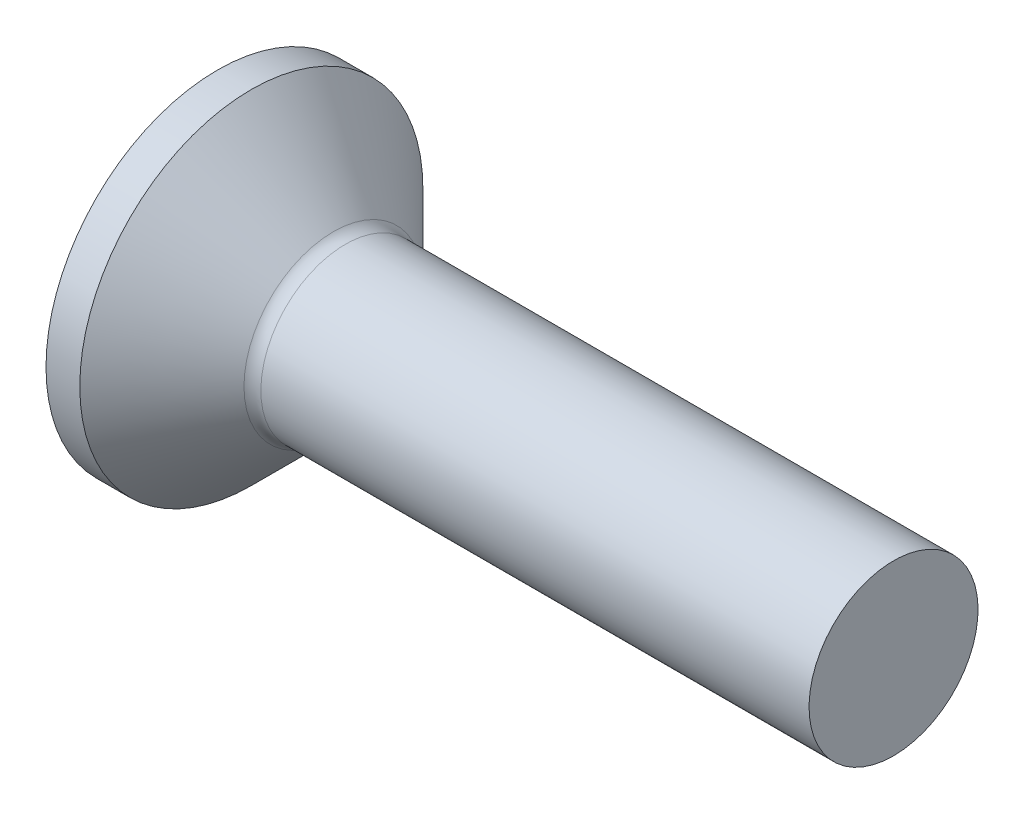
SolidWorks part; units mm, degrees
ref_plane "Front" through (0, 0, 0) normal (0, 0, 1) x (1, 0, 0)
ref_plane "Top" through (0, 0, 0) normal (0, 1, 0) x (1, 0, 0)
ref_plane "Right" through (0, 0, 0) normal (1, 0, 0) x (0, 0, -1)
other "Configuration Table"
sketch "Sketch1" plane through (-0.4925, -1.5075, 0) normal (0, 0, 1) x (0, 1, 0)
  line L0 (1.5075, -0.4925) -> (2.5225, -0.4925)
  line L1 (2.5225, -0.4925) -> (2.5225, -0.6925)
  line L2 (2.5225, -0.6925) -> (2.0075, -1.2075)
  line L3 (2.0075, -1.2075) -> (2.0075, -4.4925)
  line L4 (2.0075, -4.4925) -> (1.5075, -4.4925)
  line L5 (1.5075, -4.4925) -> (1.5075, -0.4925)
  line L6 (1.5075, 2.03) -> (1.5075, -4.03) construction
  dimension "b" = 0.2
  dimension "dk" = 2.03
  dimension "l" = 4
  dimension "d" = 1
  dimension "Angle" = 45
revolve "Base-Revolve" add sketch "Sketch1" angle 360 about L6
fillet "Fillet1" radius 0.1 1 edges at (0.715, -0.5, 0)
